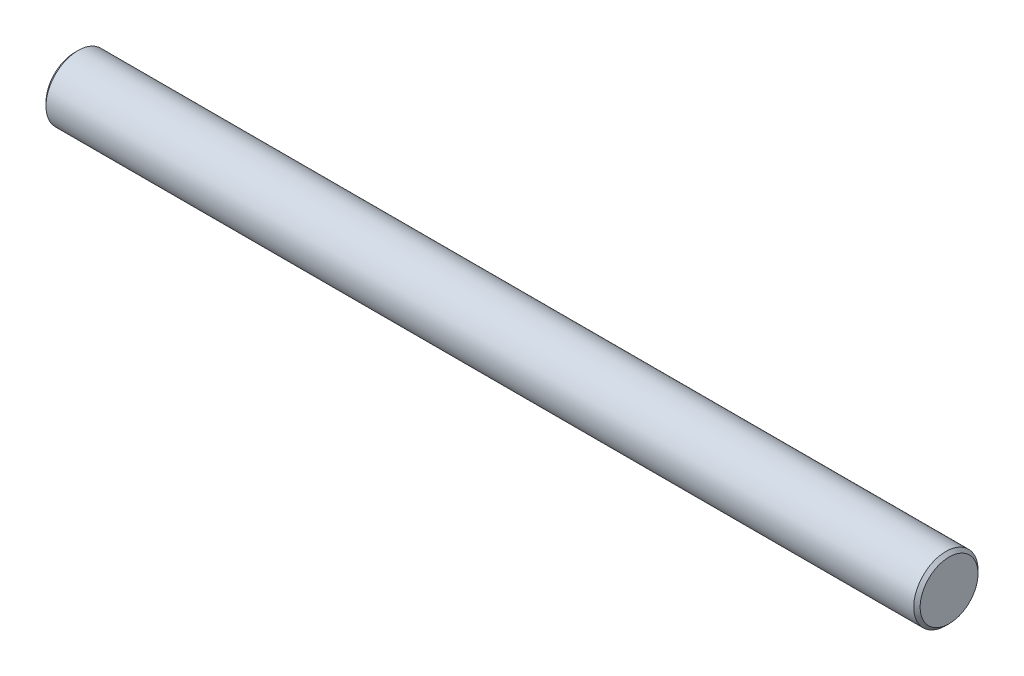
SolidWorks part; units mm, degrees
ref_plane "Front" through (0, 0, 0) normal (0, 0, 1) x (1, 0, 0)
ref_plane "Top" through (0, 0, 0) normal (0, 1, 0) x (1, 0, 0)
ref_plane "Right" through (0, 0, 0) normal (1, 0, 0) x (0, 0, -1)
sketch "Sketch1" plane through (0, 0, 0) normal (1, 0, 0) x (0, 0, -1)
  circle A0 centre (0, 0) radius 10
  dimension "D1" = 20
extrude "Extrude1" add sketch "Sketch1" along normal blind 272
chamfer "Chamfer1" distance 1 angle 45 2 edges at (0, 0, -10) (272, 0, -10)
